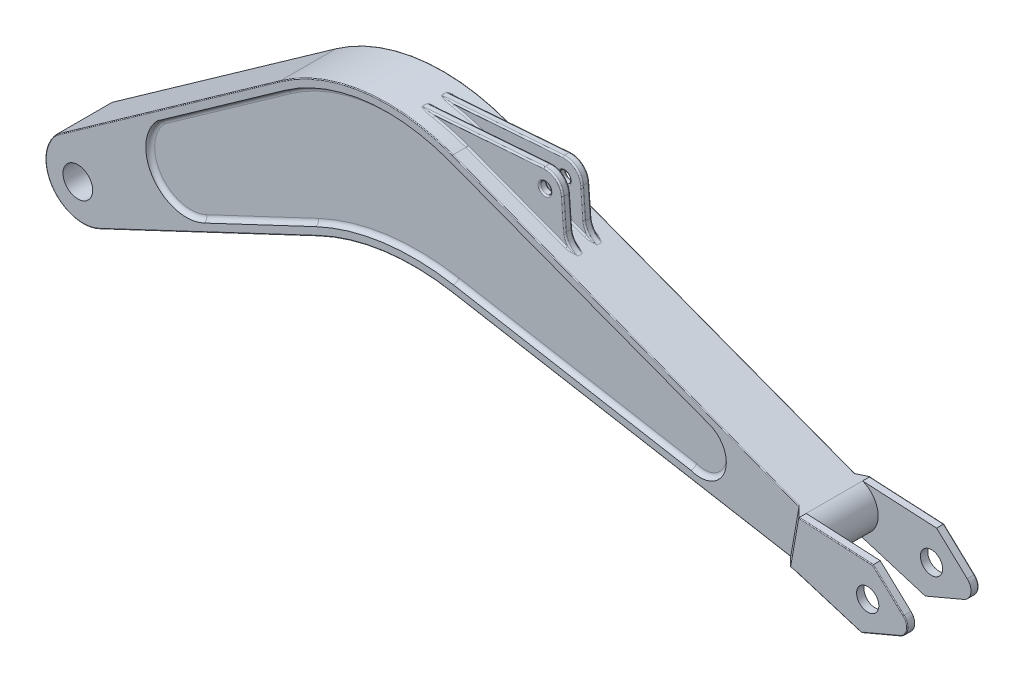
SolidWorks part; units mm, degrees
ref_plane "Front" through (0, 0, 0) normal (0, 0, 1) x (1, 0, 0)
ref_plane "Top" through (0, 0, 0) normal (0, 1, 0) x (1, 0, 0)
ref_plane "Right" through (0, 0, 0) normal (1, 0, 0) x (0, 0, -1)
sketch "Sketch1" plane through (0, 0, 0) normal (0, 0, 1) x (1, 0, 0)
  line L0 (0, 0) -> (5000, 0) construction
  line L1 (2050, 0) -> (2050, 1450) construction
  line L2 (0, 0) -> (1507.8566, 1066.5328)
  line L3 (5000, 0) -> (2669.0047, 411.0174)
  line L4 (5000, 0) -> (5055.5674, 315.1385) construction
  line L5 (5055.5674, 315.1385) -> (2671.2425, 1215.4273)
  line L6 (0, 0) -> (288.7324, -408.2078) construction
  line L7 (288.7324, -408.2078) -> (1768.1485, 290.238)
  arc A0 (5055.5674, 315.1385) -> (5000, 0) centre (4998.051, 162.8119) cw
  arc A1 (288.7324, -408.2078) -> (0, 0) centre (180.3552, -178.6483) cw
  arc A2 (1768.1485, 290.238) -> (2669.0047, 411.0174) centre (2408.5324, -1066.1943) cw
  arc A3 (2671.2425, 1215.4273) -> (1507.8566, 1066.5328) centre (2229.6875, 46.0132) ccw
  circle A4 centre (144.3662, -204.1039) radius 100
  dimension "D5" = 90
  dimension "D9" = 10
  dimension "D10" = 1500
  dimension "D11" = 1250
  dimension "D12" = 200
  dimension "D1" = 5000
  dimension "D2" = 2050
  dimension "D3" = 1450
  dimension "D4" = 10
  dimension "D6" = 320
  dimension "D7" = 500
  dimension "D8" = 90
extrude "Extrude1" add sketch "Sketch1" along normal mid plane 380
sketch "Sketch2" plane through (0, 0, 190) normal (0, 0, 1) x (1, 0, 0)
  line L0 (5055.5674, 315.1385) -> (5000, 0)
  line L1 (5027.7837, 157.5692) -> (5520.1876, 70.7452) construction
  line L2 (5055.5674, 315.1385) -> (5554.8822, 288.9705)
  line L3 (5000, 0) -> (5478.1524, -146.1859)
  line L4 (5554.8822, 288.9705) -> (5761.4634, 96.3304)
  line L5 (5478.1524, -146.1859) -> (5738.162, -35.8183)
  arc A0 (5738.162, -35.8183) -> (5761.4634, 96.3304) centre (5706.9035, 37.8221) ccw
  circle A1 centre (5520.1876, 70.7452) radius 75
  dimension "D5" = 80
  dimension "D6" = 150
  dimension "D1" = 7
  dimension "D2" = 500
  dimension "D3" = 500
  dimension "D4" = 33
  dimension "D7" = 33
extrude "Extrude2" add sketch "Sketch2" along normal blind 50
ref_plane "Plane1" through (0, 0, 40) normal (0, 0, 1) x (1, 0, 0)
sketch "Sketch3" plane through (0, 0, 40) normal (0, 0, 1) x (1, 0, 0)
  line L0 (5055.5674, 315.1385) -> (2671.2425, 1215.4273) construction
  line L1 (3335.0465, 964.7839) -> (2671.2425, 1215.4273)
  line L2 (2357.8566, 1289.4249) -> (3185.5049, 1351.8616)
  line L3 (3314.1919, 1241.2286) -> (3335.0465, 964.7839)
  arc A0 (2671.2425, 1215.4273) -> (1507.8566, 1066.5328) centre (2229.6875, 46.0132) ccw construction
  arc A1 (2671.2425, 1215.4273) -> (2357.8566, 1289.4249) centre (2229.6875, 46.0132) ccw
  arc A2 (3185.5049, 1351.8616) -> (3314.1919, 1241.2286) centre (3194.5319, 1232.2016) cw
  circle A3 centre (3194.5319, 1232.2016) radius 37.5
  point P9 (3305.1649, 1360.8885)
  dimension "D4" = 120
  dimension "D5" = 75
  dimension "D1" = 850
  dimension "D2" = 25
  dimension "D3" = 950
extrude "Extrude3" add sketch "Sketch3" along normal blind 50
sketch "Sketch4" plane through (0, 0, 190) normal (0, 0, 1) x (1, 0, 0)
  line L5 (682.0057, 421.151) -> (994.0043, -19.9504) construction
  line L6 (4402.6768, 508.2155) -> (4278.0205, 178.0758) construction
  line L10 (4959.442, 57.9228) -> (4999.1297, 283.003)
  line L11 (4999.1297, 283.003) -> (2653.5803, 1168.6507)
  line L12 (1536.7299, 1025.712) -> (32.6419, -38.1551)
  line L13 (267.3862, -362.9934) -> (1746.8023, 335.4524)
  line L14 (2677.6871, 460.2578) -> (4959.442, 57.9228)
  line L16 (4402.6768, 508.2155) -> (2653.5803, 1168.6507)
  line L17 (1536.7299, 1025.712) -> (682.0057, 421.151)
  line L18 (994.0043, -19.9504) -> (1746.8023, 335.4524)
  line L19 (2677.6871, 460.2578) -> (4278.0205, 178.0758)
  circle A3 centre (5520.1876, 70.7452) radius 75 construction
  circle A4 centre (144.3662, -204.1039) radius 100 construction
  arc A5 (994.0043, -19.9504) -> (682.0057, 421.151) centre (876.8941, 228.1072) cw
  arc A6 (2653.5803, 1168.6507) -> (1536.7299, 1025.712) centre (2229.6875, 46.0132) ccw
  arc A7 (32.6419, -38.1551) -> (267.3862, -362.9934) centre (180.3552, -178.6483) ccw
  arc A8 (2677.6871, 460.2578) -> (1746.8023, 335.4524) centre (2408.5324, -1066.1943) ccw
  arc A9 (2653.5803, 1168.6507) -> (1536.7299, 1025.712) centre (2229.6875, 46.0132) ccw
  arc A10 (4402.6768, 508.2155) -> (4278.0205, 178.0758) centre (4340.3487, 343.1457) cw
  arc A11 (2677.6871, 460.2578) -> (1746.8023, 335.4524) centre (2408.5324, -1066.1943) ccw
  dimension "D2" = 1200
  dimension "D3" = 800
  dimension "D1" = 50
extrude "Cut-Extrude1" cut sketch "Sketch4" against normal blind 30
mirror "Mirror1" about plane through (0, 0, 0) normal (0, 0, 1)
fillet "Fillet1" radius 120
fillet "Fillet2" radius 10
fillet "Fillet3" radius 30
chamfer "Chamfer1" distance 50 angle 45
fillet "Fillet4" radius 5
